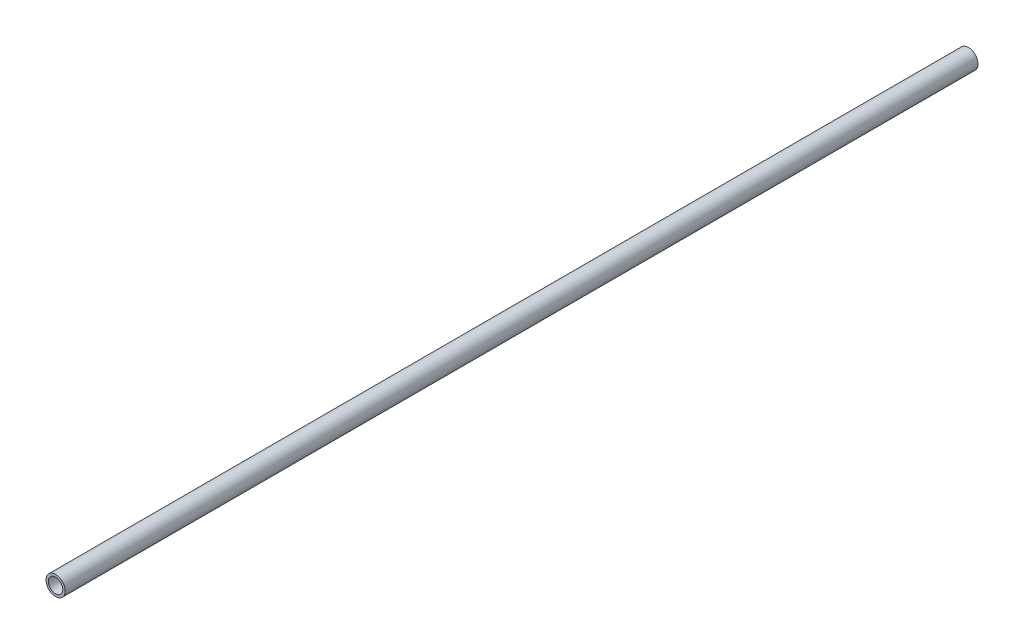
SolidWorks part; units mm, degrees
ref_plane "Plan de face" through (0, 0, 0) normal (0, 0, 1) x (1, 0, 0)
ref_plane "Plan de dessus" through (0, 0, 0) normal (0, 1, 0) x (1, 0, 0)
ref_plane "Plan de droite" through (0, 0, 0) normal (1, 0, 0) x (0, 0, -1)
sketch "Esquisse1" plane through (0, 0, 0) normal (0, 0, 1) x (1, 0, 0)
  circle A0 centre (0, 0) radius 3
  dimension "D1" = 6
extrude "Extru.-Mince1" add sketch "Esquisse1" along normal blind 380 thin
ref_plane "Milieu" through (0, 0, 190) normal (0, 0, 1) x (1, 0, 0)
